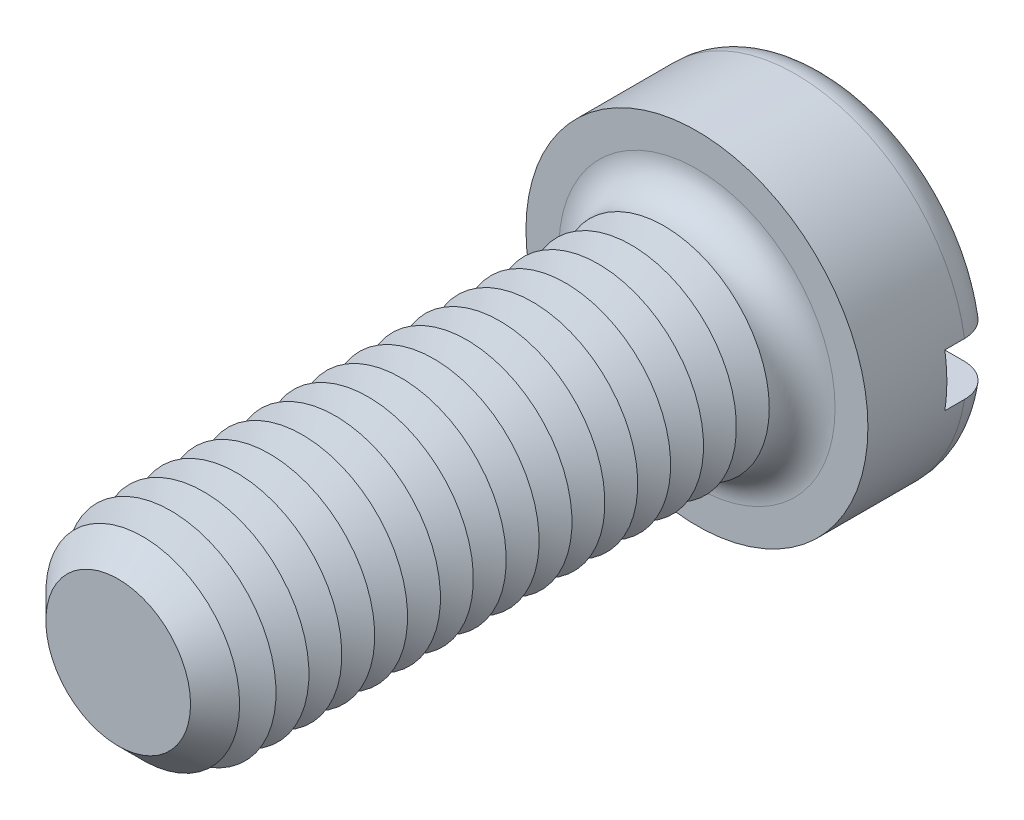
SolidWorks part; units mm, degrees
ref_plane "Front Plane" through (0, 0, 0) normal (0, 0, 1) x (1, 0, 0)
ref_plane "Top Plane" through (0, 0, 0) normal (0, 1, 0) x (1, 0, 0)
ref_plane "Right Plane" through (0, 0, 0) normal (1, 0, 0) x (0, 0, -1)
sketch "Sketch3" plane through (0, 0, 0) normal (0, 0, 1) x (1, 0, 0)
  circle A0 centre (0, 0) radius 6.5
  dimension "D1" = 13
extrude "Boss-Extrude2" add sketch "Sketch3" against normal blind 5
sketch "Sketch4" plane through (0, 0, 0) normal (0, 0, 1) x (1, 0, 0)
  circle A0 centre (0, 0) radius 4
  dimension "D1" = 8
extrude "Boss-Extrude3" add sketch "Sketch4" along normal blind 22
fillet "Fillet1" radius 1.25 2 edges at (6.5, 0, -5) (4, 0, 0)
chamfer "Chamfer1" distance 1.25 angle 45 1 edges at (4, 0, 22)
sketch "Sketch5" plane through (0, 0, 0) normal (1, 0, 0) x (0, 0, -1)
  line L0 (1.6944, 0) -> (-7.6738, 0) construction
sketch "Sketch6" plane through (0, 0, 0) normal (1, 0, 0) x (0, 0, -1)
  line L0 (-1.25, 4) -> (-1.875, 2.9175)
  line L1 (-1.875, 2.9175) -> (-2.5, 4)
  line L2 (-1.25, 4) -> (-20.75, 4) construction
  line L3 (-2.5, 4) -> (-1.25, 4)
  dimension "D1" = 1.25
revolve "Cut-Revolve1" cut sketch "Sketch6" angle 360 about L0
pattern_linear "LPattern1" count 16 spacing 1.25 along (0, 0, 1) of "Cut-Revolve1"
sketch "Sketch8" plane through (0, 0, -5) normal (0, 0, -1) x (-1, 0, 0)
  line L1 (6.5, -1) -> (-6.5, -1)
  line L2 (6.5, -1) -> (6.5, 1)
  line L3 (6.5, 1) -> (-6.5, 1)
  line L4 (-6.5, -1) -> (-6.5, 1)
  line L5 (6.5, -1) -> (-6.5, 1) construction
  line L6 (6.5, 1) -> (-6.5, -1) construction
  point P0 (0, 0)
  dimension "D1" = 13
  dimension "D2" = 2
extrude "Cut-Extrude1" cut sketch "Sketch8" against normal blind 2
